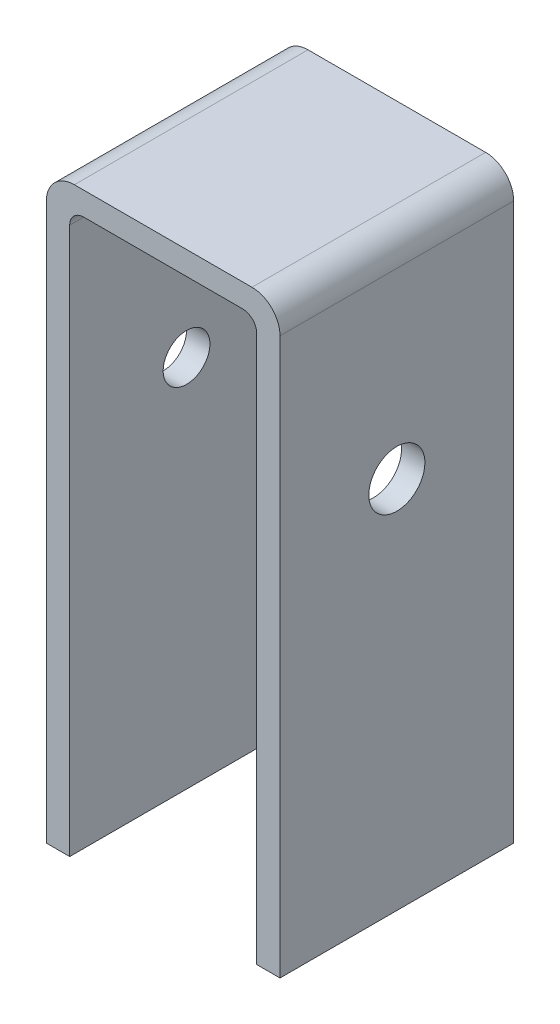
SolidWorks part; units mm, degrees
ref_plane "Plan1" through (0, 0, 0) normal (0, 0, 1) x (1, 0, 0)
ref_plane "Plan2" through (0, 0, 0) normal (0, 1, 0) x (1, 0, 0)
ref_plane "Plan3" through (0, 0, 0) normal (1, 0, 0) x (0, 0, -1)
sketch "Esquisse1" plane through (0, 0, 0) normal (0, 0, 1) x (1, 0, 0)
  line L0 (0, 0) -> (5, 0)
  line L1 (5, 0) -> (5, 117)
  line L2 (8, 120) -> (42, 120)
  line L3 (45, 117) -> (45, 0)
  line L4 (45, 0) -> (50, 0)
  line L5 (50, 0) -> (50, 119)
  line L6 (44, 125) -> (6, 125)
  line L7 (0, 119) -> (0, 0)
  arc A0 (8, 120) -> (5, 117) centre (8, 117) ccw
  arc A1 (45, 117) -> (42, 120) centre (42, 117) ccw
  arc A2 (6, 125) -> (0, 119) centre (6, 119) ccw
  arc A3 (44, 125) -> (50, 119) centre (44, 119) cw
  point P11 (5, 120)
  dimension "D6" = 3
  dimension "D7" = 6
  dimension "D1" = 40
  dimension "D2" = 5
  dimension "D3" = 5
  dimension "D4" = 120
  dimension "D5" = 5
extrude "Extrusion1" add sketch "Esquisse1" along normal blind 50
sketch "Esquisse2" plane through (50, 0, 0) normal (1, 0, 0) x (0, 0, -1)
  line L0 (-50, 0) -> (0, 0) construction
  line L1 (0, 0) -> (0, 119) construction
  circle A0 centre (-25, 80) radius 6
  dimension "D1" = 80
  dimension "D2" = 25
  dimension "D3" = 12
extrude "Enlèv. mat.-Extru.1" cut sketch "Esquisse2" against normal blind 5
hole_wizard "Trou taraudé M10x1.51" positions "Esquisse4" profile "Esquisse3" tap size "M10x1.5" standard "ISO"
sketch "Esquisse4" plane through (5, 0, 0) normal (1, 0, 0) x (0, 0, -1)
  line L0 (0, 0) -> (0, 117) construction
  line L1 (-50, 0) -> (0, 0) construction
  point P0 (-25, 80)
  dimension "D1" = 25
  dimension "D2" = 80
sketch "Esquisse3" plane through (5, 80, 25) normal (0, 1, 0) x (0, 0, -1)
  line L0 (0, 0) -> (0, 5)
  line L1 (0, 5) -> (4.25, 5)
  line L3 (4.25, 5) -> (4.25, 20)
  line L4 (4.25, 20) -> (5, 20)
  line L5 (5, 20) -> (5, 0)
  line L7 (5, 0) -> (0, 0)
  line L11 (0, -6.35) -> (0, 107.95) construction
  dimension "Diamètre du trou pour taraudage jusqu'au prochain" = 8.5
  dimension "Profondeur du trou pour taraudage jusqu'au prochain" = 5
  dimension "Diamètre principal du filetage" = 10
  dimension "Profondeur du filetage" = 20
